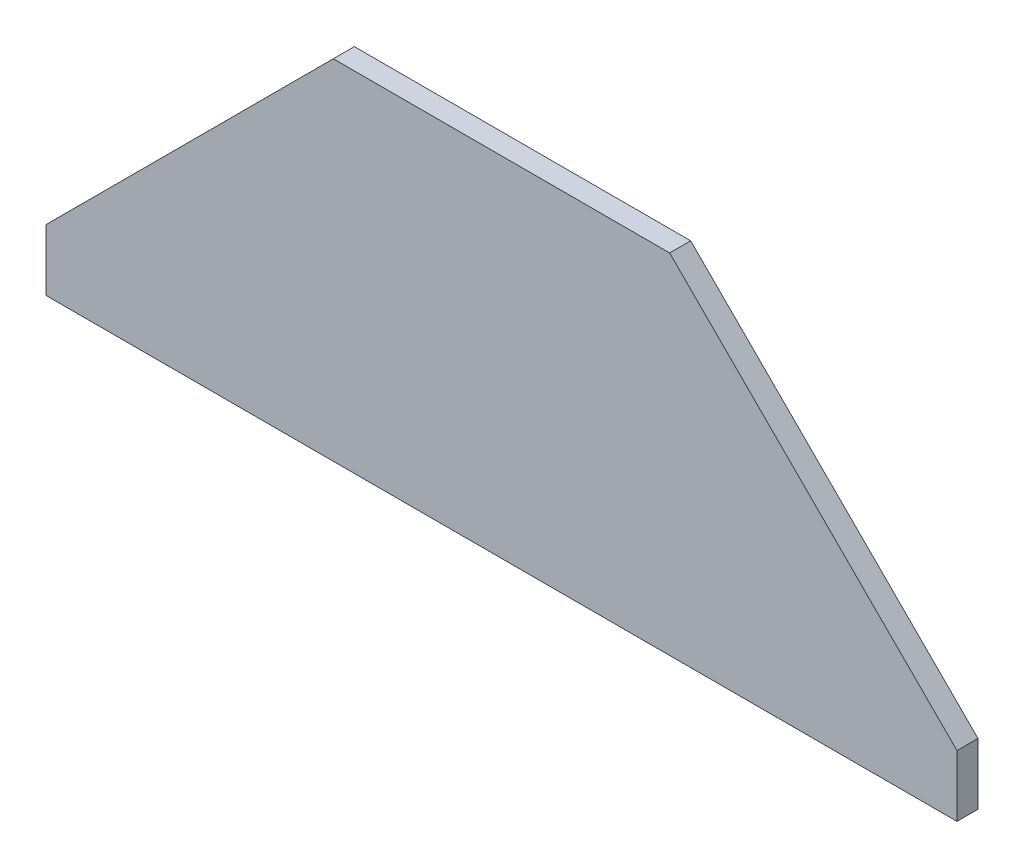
SolidWorks part; units mm, degrees
ref_plane "Front Plane" through (0, 0, 0) normal (0, 0, 1) x (1, 0, 0)
ref_plane "Top Plane" through (0, 0, 0) normal (0, 1, 0) x (1, 0, 0)
ref_plane "Right Plane" through (0, 0, 0) normal (1, 0, 0) x (0, 0, -1)
sketch "Sketch1" plane through (0, 0, 0) normal (0, 0, 1) x (1, 0, 0)
  line L0 (-412.75, -102.3937) -> (-152.4, 157.9563)
  line L1 (-412.75, -157.9562) -> (412.75, -157.9562)
  line L2 (-412.75, -157.9562) -> (-412.75, 157.9563)
  line L3 (-412.75, 157.9563) -> (412.75, 157.9563)
  line L4 (412.75, -157.9562) -> (412.75, 157.9563)
  line L5 (-412.75, -157.9562) -> (412.75, 157.9563) construction
  line L6 (-412.75, 157.9563) -> (412.75, -157.9562) construction
  line L7 (152.4, 157.9563) -> (412.75, -102.3937)
  point P0 (0, 0)
  dimension "D1" = 825.5
  dimension "D2" = 315.9125
  dimension "D3" = 260.35
  dimension "D4" = 260.35
  dimension "D5" = 260.35
  dimension "D6" = 260.35
extrude "Extrude1" add sketch "Sketch1" along normal mid plane 19.05 contours L7 L3 L0 L2 L1 L4
